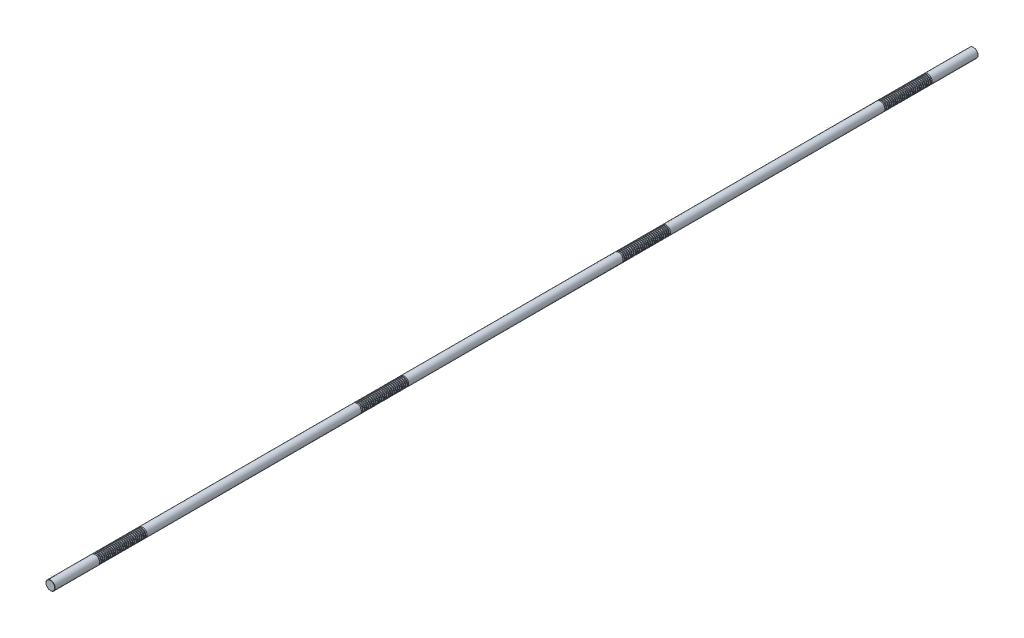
SolidWorks part; units mm, degrees
ref_plane "Front Plane" through (0, 0, 0) normal (0, 0, 1) x (1, 0, 0)
ref_plane "Top Plane" through (0, 0, 0) normal (0, 1, 0) x (1, 0, 0)
ref_plane "Right Plane" through (0, 0, 0) normal (1, 0, 0) x (0, 0, -1)
sketch "Sketch1" plane through (0, 0, 0) normal (0, 0, 1) x (1, 0, 0)
  circle A0 centre (0, 0) radius 10
  dimension "D1" = 20
extrude "Boss-Extrude1" add sketch "Sketch1" along normal mid plane 2000
chamfer "Chamfer1" distance 0.5 angle 45 2 edges at (10, 0, -1000) (10, 0, 1000)
sketch "Sketch2" plane through (0, 0, 0) normal (1, 0, 0) x (0, 0, -1)
  line L0 (900.3014, 10) -> (897.6986, 10)
  line L1 (999.5, 10) -> (-999.5, 10) construction
  line L2 (897.6986, 10) -> (898.3014, 7.75)
  line L3 (898.3014, 7.75) -> (899.6986, 7.75)
  line L4 (899.6986, 7.75) -> (900.3014, 10)
  line L5 (1000, -9.5) -> (1000, 9.5) construction
  point P4 (899, 10)
  point P7 (899, 7.75)
  point P8 (900, 8.875)
  point P9 (898, 8.875)
  dimension "D1" = 2
  dimension "D2" = 100
  dimension "D3" = 2.25
  dimension "D4" = 30
revolve "Cut-Revolve1" cut sketch "Sketch2" angle 360 about axis through (0, 0, 1000) along (0, 0, -1)
pattern_linear "LPattern1" count 26 spacing 4 along (0, 0, 1) of "Cut-Revolve1"
pattern_linear "LPattern2" count 4 spacing 567 along (0, 0, 1) of "Cut-Revolve1", "LPattern1"
